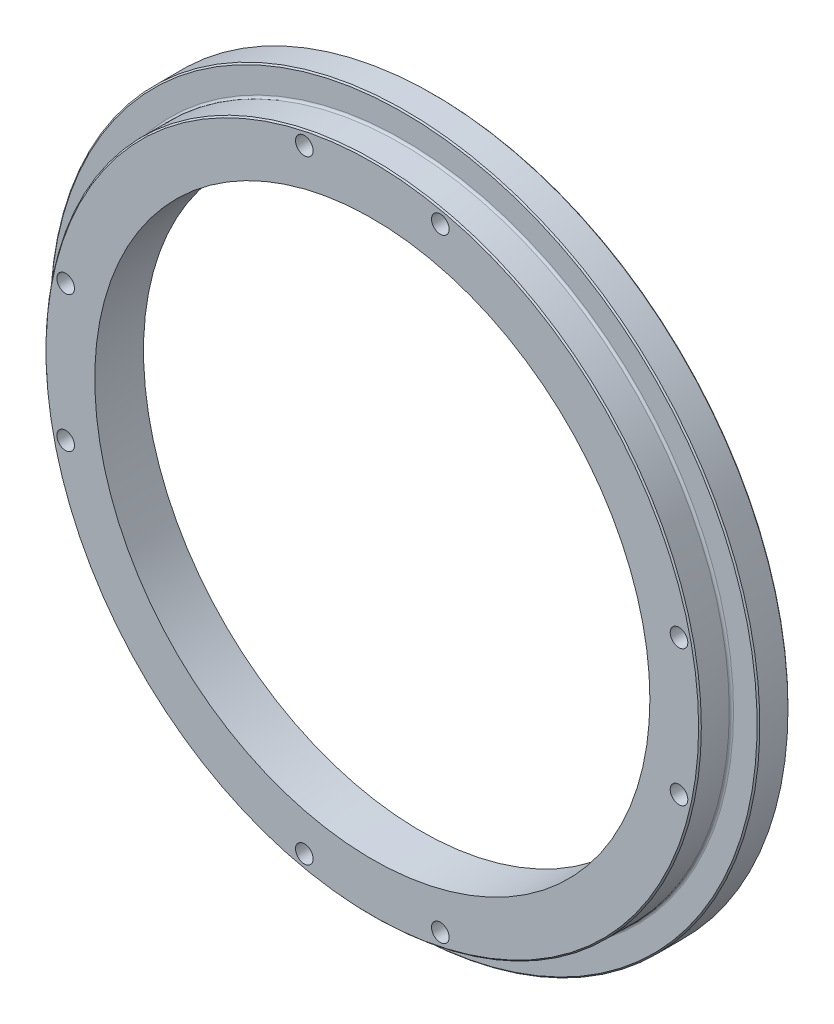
SolidWorks part; units mm, degrees
ref_plane "Plan de face" through (0, 0, 0) normal (0, 0, 1) x (1, 0, 0)
ref_plane "Plan de dessus" through (0, 0, 0) normal (0, 1, 0) x (1, 0, 0)
ref_plane "Plan de droite" through (0, 0, 0) normal (1, 0, 0) x (0, 0, -1)
sketch "Esquisse1" plane through (0, 0, 0) normal (0, 0, 1) x (1, 0, 0)
  circle A0 centre (0, 0) radius 121
  circle A1 centre (0, 0) radius 102.5
  dimension "D1" = 242
  dimension "D2" = 205
extrude "Extrusion1" add sketch "Esquisse1" along normal blind 23
sketch "Esquisse2" plane through (0, 0, 23) normal (0, 0, 1) x (1, 0, 0)
  line L0 (0, 0) -> (-26.7363, 120.5997) construction
  line L1 (0, 0) -> (0, 138.1683) construction
  circle A0 centre (0, 0) radius 116 construction
  circle A1 centre (-25.107, 113.2503) radius 3.25
  circle A2 centre (25.107, 113.2503) radius 3.25
  dimension "D1" = 6.5
  dimension "D2" = 232
  dimension "D3" = 12.5
extrude "Extrusion2" cut sketch "Esquisse2" against normal through all
pattern_circular "Répétition circulaire1" count 4 over 360 about axis through (0, 0, 0) along (0, 0, 1) of "Extrusion2"
sketch "Esquisse3" plane through (0, 0, 0) normal (0, 0, 1) x (1, 0, 0)
  circle A0 centre (0, 0) radius 109.75
  circle A1 centre (0, 0) radius 102.5
  circle A2 centre (0, 0) radius 102.5 construction
  dimension "D1" = 219.5
extrude "Extrusion4" cut sketch "Esquisse3" along normal blind 5
sketch "Esquisse4" plane through (0, 0, 0) normal (0, 0, -1) x (-1, 0, 0)
  circle A0 centre (0, 0) radius 131
  circle A1 centre (0, 0) radius 121 construction
  circle A2 centre (0, 0) radius 121
  dimension "D1" = 10
extrude "Extrusion5" add sketch "Esquisse4" against normal blind 11.4
fillet "Congé1" radius 0.8 1 edges at (-121, 0, 11.4)
chamfer "Chanfrein1" distance 0.5 angle 45 3 edges at (-131, 0, 11.4) (-131, 0, 0) (121, 0, 23)
